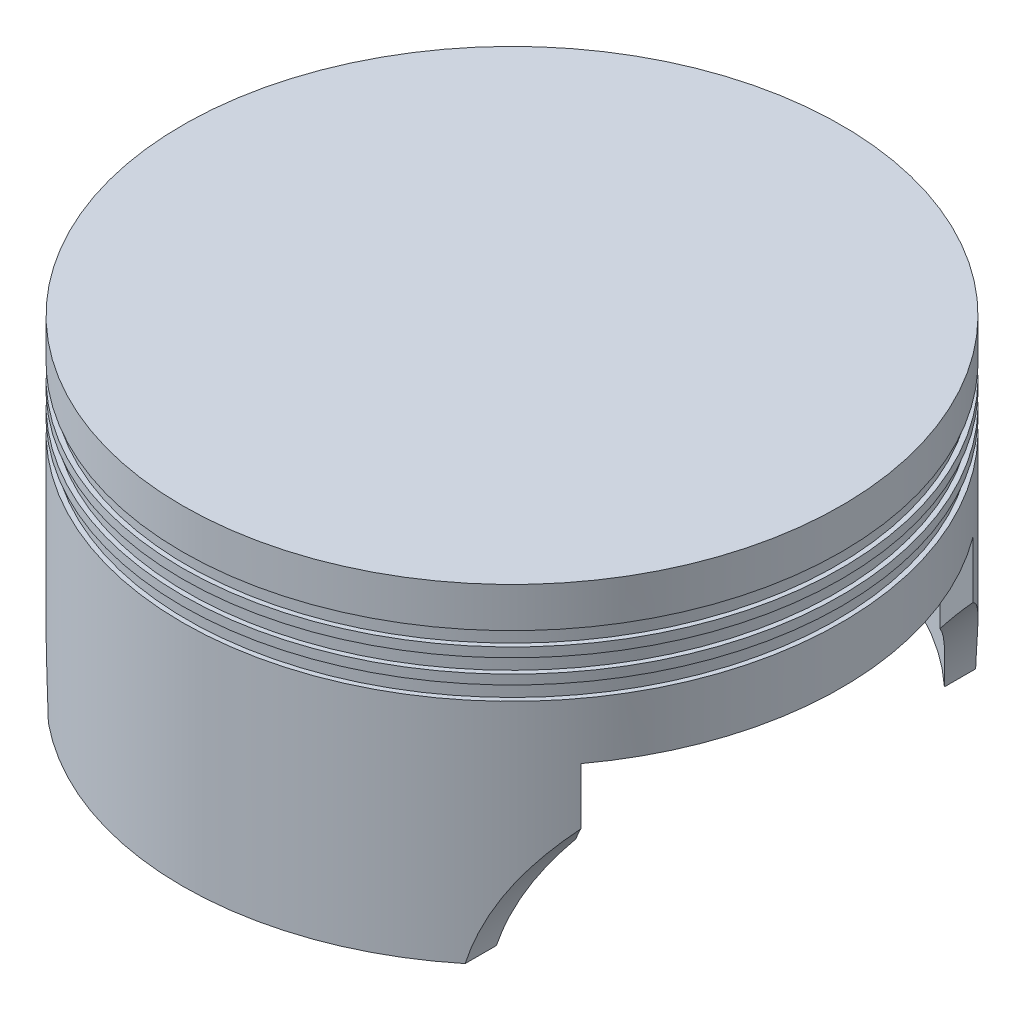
SolidWorks part; units mm, degrees
ref_plane "Front Plane" through (0, 0, 0) normal (0, 0, 1) x (1, 0, 0)
ref_plane "Top Plane" through (0, 0, 0) normal (0, 1, 0) x (1, 0, 0)
ref_plane "Right Plane" through (0, 0, 0) normal (1, 0, 0) x (0, 0, -1)
sketch "Sketch1" plane through (0, 0, 0) normal (0, 1, 0) x (1, 0, 0)
  circle A0 centre (0, 0) radius 70
  dimension "D1" = 140
extrude "Boss-Extrude1" add sketch "Sketch1" against normal blind 70
sketch "Sketch2" plane through (0, 0, 0) normal (1, 0, 0) x (0, 0, -1)
  line L0 (-70, 0) -> (-70, -70) construction
  line L1 (-71, -8.5) -> (-69, -8.5)
  line L2 (-71, -8.5) -> (-71, -11.5)
  line L3 (-71, -11.5) -> (-69, -11.5)
  line L4 (-69, -8.5) -> (-69, -11.5)
  line L5 (-71, -8.5) -> (-69, -11.5) construction
  line L6 (-71, -11.5) -> (-69, -8.5) construction
  line L8 (70, 0) -> (-70, 0) construction
  point P0 (-70, -10)
  dimension "D1" = 2
  dimension "D2" = 3
  dimension "D3" = 10
revolve "Cut-Revolve1" cut sketch "Sketch2" angle 360 about axis through (0, -70, 0) along (0, 1, 0)
pattern_linear "LPattern1" count 3 spacing 5 along (0, -1, 0) of "Cut-Revolve1"
shell "Shell1" thickness 10
sketch "Sketch3" plane through (0, -70, 0) normal (0, -1, 0) x (1, 0, 0)
  circle A2 centre (0, 0) radius 65
  circle A3 centre (0, 0) radius 65
  dimension "D1" = 5
extrude "Cut-Extrude1" cut sketch "Sketch3" against normal up to surface (38.5 mm away)
sketch "Sketch4" plane through (0, -70, 0) normal (0, -1, 0) x (1, 0, 0)
  line L0 (0, 0) -> (0, 70) construction
  line L1 (0, 0) -> (-70, 0) construction
  line L2 (-52.2507, 38.6635) -> (-56.27, 41.6376)
  line L3 (52.2507, 38.6635) -> (56.27, 41.6376)
  line L4 (52.2507, -38.6635) -> (56.27, -41.6376)
  line L5 (-52.2507, -38.6635) -> (-56.27, -41.6376)
  circle A0 centre (0, 0) radius 65 construction
  circle A1 centre (0, 0) radius 70 construction
  arc A2 (52.2507, 38.6635) -> (-52.2507, 38.6635) centre (0, 0) ccw
  arc A3 (56.27, 41.6376) -> (-56.27, 41.6376) centre (0, 0) ccw
  arc A4 (56.27, -41.6376) -> (-56.27, -41.6376) centre (0, 0) cw
  arc A5 (52.2507, -38.6635) -> (-52.2507, -38.6635) centre (0, 0) cw
  dimension "D1" = 107
extrude "Cut-Extrude2" cut sketch "Sketch4" against normal offset from surface (36.5 mm away) 2 flip side to cut
sketch "Sketch5" plane through (0, 0, 0) normal (0, 0, 1) x (1, 0, 0)
  line L3 (44.27, -70) -> (56.27, -70)
  line L4 (56.27, -70) -> (56.27, -45.5)
  line L5 (0, 0) -> (0, -70) construction
  line L6 (-56.27, -70) -> (-56.27, -45.5)
  line L7 (-44.27, -70) -> (-56.27, -70)
  line L8 (56.27, -33.5) -> (56.27, -70) construction
  line L9 (56.27, -33.5) -> (70, -33.5) construction
  arc A0 (44.27, -70) -> (56.27, -45.5) centre (98.1203, -81.1869) cw
  arc A1 (-44.27, -70) -> (-56.27, -45.5) centre (-98.1203, -81.1869) ccw
  dimension "D1" = 55
  dimension "D2" = 12
  dimension "D3" = 12
extrude "Cut-Extrude3" cut sketch "Sketch5" against normal through all both and the other way through all
